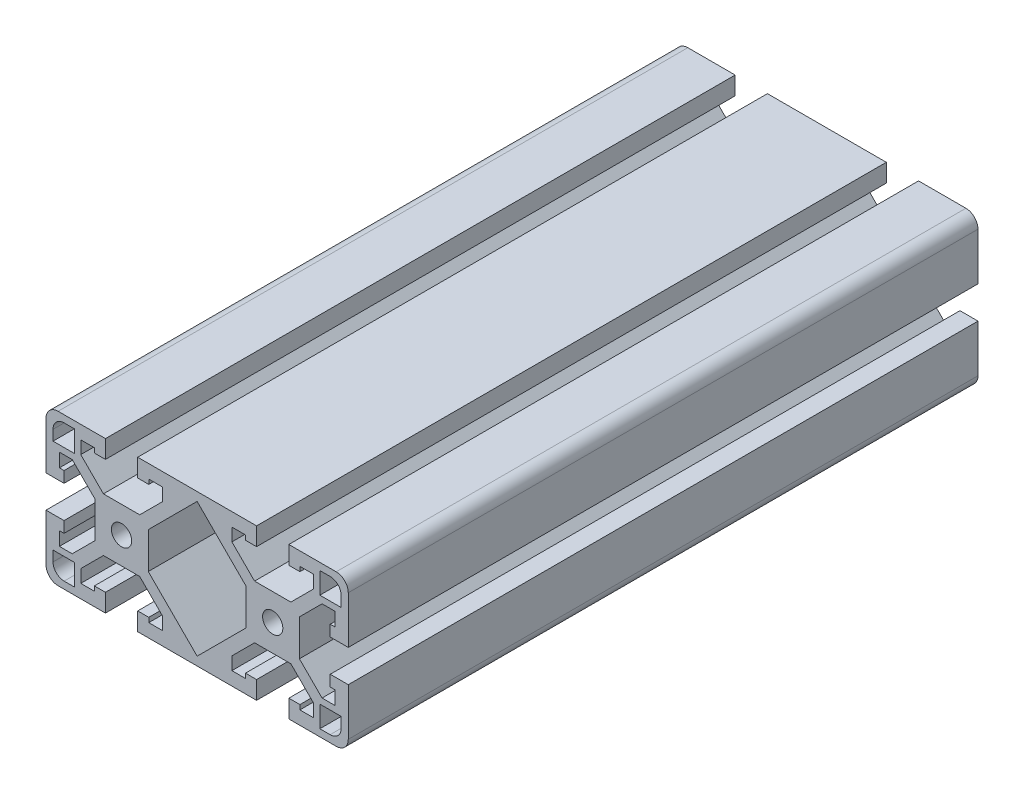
SolidWorks part; units mm, degrees
ref_plane "Front" through (0, 0, 0) normal (0, 0, 1) x (1, 0, 0)
ref_plane "Top" through (0, 0, 0) normal (0, 1, 0) x (1, 0, 0)
ref_plane "Right" through (0, 0, 0) normal (1, 0, 0) x (0, 0, -1)
sketch "Sketch1" plane through (0, 0, 0) normal (0, 0, 1) x (1, 0, 0)
  line L0 (-12.319, 4.5757) -> (-12.319, -4.5757)
  line L1 (0, 16.8947) -> (-12.319, 4.5757)
  line L2 (12.319, 4.5757) -> (0, 16.8947)
  line L3 (12.319, -4.5757) -> (12.319, 4.5757)
  line L4 (0, -16.8947) -> (12.319, -4.5757)
  line L5 (-12.319, -4.5757) -> (0, -16.8947)
  line L6 (-30.9372, 11.8872) -> (-30.9372, 17.272)
  line L7 (-36.322, 11.8872) -> (-30.9372, 11.8872)
  line L8 (-36.322, 14.478) -> (-36.322, 11.8872)
  line L9 (-30.9372, 17.272) -> (-33.528, 17.272)
  line L10 (-30.9372, -17.272) -> (-30.9372, -11.8872)
  line L11 (-33.528, -17.272) -> (-30.9372, -17.272)
  line L12 (-36.322, -11.8872) -> (-36.322, -14.478)
  line L13 (-30.9372, -11.8872) -> (-36.322, -11.8872)
  line L14 (36.322, -11.8872) -> (30.9372, -11.8872)
  line L15 (36.322, -14.478) -> (36.322, -11.8872)
  line L16 (30.9372, -17.272) -> (33.528, -17.272)
  line L17 (30.9372, -11.8872) -> (30.9372, -17.272)
  line L18 (30.9372, 17.272) -> (30.9372, 11.8872)
  line L19 (33.528, 17.272) -> (30.9372, 17.272)
  line L20 (36.322, 11.8872) -> (36.322, 14.478)
  line L21 (30.9372, 11.8872) -> (36.322, 11.8872)
  line L22 (-29.337, 12.4423) -> (-29.337, 15.6718)
  line L23 (-29.337, 15.6718) -> (-25.908, 15.6718)
  line L24 (-25.908, 15.6718) -> (-25.908, 14.5034)
  line L25 (-25.908, 14.5034) -> (-23.114, 14.5034)
  line L26 (-23.114, 14.5034) -> (-23.114, 19.05)
  line L27 (-23.114, 19.05) -> (-35.052, 19.05)
  line L28 (-38.1, 16.002) -> (-38.1, 4.064)
  line L29 (-38.1, 4.064) -> (-33.5534, 4.064)
  line L30 (-33.5534, 4.064) -> (-33.5534, 6.858)
  line L31 (-33.5534, 6.858) -> (-34.7218, 6.858)
  line L32 (-34.7218, 6.858) -> (-34.7218, 10.287)
  line L33 (-34.7218, 10.287) -> (-31.4923, 10.287)
  line L34 (-31.4923, 10.287) -> (-25.781, 4.5757)
  line L35 (-25.781, 4.5757) -> (-25.781, -4.5757)
  line L36 (-25.781, -4.5757) -> (-31.4923, -10.287)
  line L37 (-31.4923, -10.287) -> (-34.7218, -10.287)
  line L38 (-34.7218, -10.287) -> (-34.7218, -6.858)
  line L39 (-34.7218, -6.858) -> (-33.5534, -6.858)
  line L40 (-33.5534, -6.858) -> (-33.5534, -4.064)
  line L41 (-33.5534, -4.064) -> (-38.1, -4.064)
  line L42 (-38.1, -4.064) -> (-38.1, -16.002)
  line L43 (-35.052, -19.05) -> (-23.114, -19.05)
  line L44 (-23.114, -19.05) -> (-23.114, -14.5034)
  line L45 (-23.114, -14.5034) -> (-25.908, -14.5034)
  line L46 (-25.908, -14.5034) -> (-25.908, -15.6718)
  line L47 (-25.908, -15.6718) -> (-29.337, -15.6718)
  line L48 (-29.337, -15.6718) -> (-29.337, -12.4423)
  line L49 (-29.337, -12.4423) -> (-23.6257, -6.731)
  line L50 (-23.6257, -6.731) -> (-14.4743, -6.731)
  line L51 (-14.4743, -6.731) -> (-8.763, -12.4423)
  line L52 (-8.763, -12.4423) -> (-8.763, -15.6718)
  line L53 (-8.763, -15.6718) -> (-12.192, -15.6718)
  line L54 (-12.192, -15.6718) -> (-12.192, -14.5034)
  line L55 (-12.192, -14.5034) -> (-14.986, -14.5034)
  line L56 (-14.986, -14.5034) -> (-14.986, -19.05)
  line L57 (-14.986, -19.05) -> (14.986, -19.05)
  line L58 (14.986, -19.05) -> (14.986, -14.5034)
  line L59 (14.986, -14.5034) -> (12.192, -14.5034)
  line L60 (12.192, -14.5034) -> (12.192, -15.6718)
  line L61 (12.192, -15.6718) -> (8.763, -15.6718)
  line L62 (8.763, -15.6718) -> (8.763, -12.4423)
  line L63 (8.763, -12.4423) -> (14.4743, -6.731)
  line L64 (14.4743, -6.731) -> (23.6257, -6.731)
  line L65 (23.6257, -6.731) -> (29.337, -12.4423)
  line L66 (29.337, -12.4423) -> (29.337, -15.6718)
  line L67 (29.337, -15.6718) -> (25.908, -15.6718)
  line L68 (25.908, -15.6718) -> (25.908, -14.5034)
  line L69 (25.908, -14.5034) -> (23.114, -14.5034)
  line L70 (23.114, -14.5034) -> (23.114, -19.05)
  line L71 (23.114, -19.05) -> (35.052, -19.05)
  line L72 (38.1, -16.002) -> (38.1, -4.064)
  line L73 (38.1, -4.064) -> (33.5534, -4.064)
  line L74 (33.5534, -4.064) -> (33.5534, -6.858)
  line L75 (33.5534, -6.858) -> (34.7218, -6.858)
  line L76 (34.7218, -6.858) -> (34.7218, -10.287)
  line L77 (34.7218, -10.287) -> (31.4923, -10.287)
  line L78 (31.4923, -10.287) -> (25.781, -4.5757)
  line L79 (25.781, -4.5757) -> (25.781, 4.5757)
  line L80 (25.781, 4.5757) -> (31.4923, 10.287)
  line L81 (31.4923, 10.287) -> (34.7218, 10.287)
  line L82 (34.7218, 10.287) -> (34.7218, 6.858)
  line L83 (34.7218, 6.858) -> (33.5534, 6.858)
  line L84 (33.5534, 6.858) -> (33.5534, 4.064)
  line L85 (33.5534, 4.064) -> (38.1, 4.064)
  line L86 (38.1, 4.064) -> (38.1, 16.002)
  line L87 (35.052, 19.05) -> (23.114, 19.05)
  line L88 (23.114, 19.05) -> (23.114, 14.5034)
  line L89 (23.114, 14.5034) -> (25.908, 14.5034)
  line L90 (25.908, 14.5034) -> (25.908, 15.6718)
  line L91 (25.908, 15.6718) -> (29.337, 15.6718)
  line L92 (29.337, 15.6718) -> (29.337, 12.4423)
  line L93 (29.337, 12.4423) -> (23.6257, 6.731)
  line L94 (23.6257, 6.731) -> (14.4743, 6.731)
  line L95 (14.4743, 6.731) -> (8.763, 12.4423)
  line L96 (8.763, 12.4423) -> (8.763, 15.6718)
  line L97 (8.763, 15.6718) -> (12.192, 15.6718)
  line L98 (12.192, 15.6718) -> (12.192, 14.5034)
  line L99 (12.192, 14.5034) -> (14.986, 14.5034)
  line L100 (14.986, 14.5034) -> (14.986, 19.05)
  line L101 (14.986, 19.05) -> (-14.986, 19.05)
  line L102 (-14.986, 19.05) -> (-14.986, 14.5034)
  line L103 (-14.986, 14.5034) -> (-12.192, 14.5034)
  line L104 (-12.192, 14.5034) -> (-12.192, 15.6718)
  line L105 (-12.192, 15.6718) -> (-8.763, 15.6718)
  line L106 (-8.763, 15.6718) -> (-8.763, 12.4423)
  line L107 (-8.763, 12.4423) -> (-14.4743, 6.731)
  line L108 (-14.4743, 6.731) -> (-23.6257, 6.731)
  line L109 (-23.6257, 6.731) -> (-29.337, 12.4423)
  circle A0 centre (-19.05, 0) radius 2.5527
  circle A1 centre (19.05, 0) radius 2.5527
  arc A2 (-35.052, 19.05) -> (-38.1, 16.002) centre (-35.052, 16.002) ccw
  arc A3 (-38.1, -16.002) -> (-35.052, -19.05) centre (-35.052, -16.002) ccw
  arc A4 (35.052, -19.05) -> (38.1, -16.002) centre (35.052, -16.002) ccw
  arc A5 (38.1, 16.002) -> (35.052, 19.05) centre (35.052, 16.002) ccw
  arc A6 (-33.528, 17.272) -> (-36.322, 14.478) centre (-33.528, 14.478) ccw
  arc A7 (-36.322, -14.478) -> (-33.528, -17.272) centre (-33.528, -14.478) ccw
  arc A8 (33.528, -17.272) -> (36.322, -14.478) centre (33.528, -14.478) ccw
  arc A9 (36.322, 14.478) -> (33.528, 17.272) centre (33.528, 14.478) ccw
extrude "Boss-Extrude1" add sketch "Sketch1" along normal mid plane 158.75
